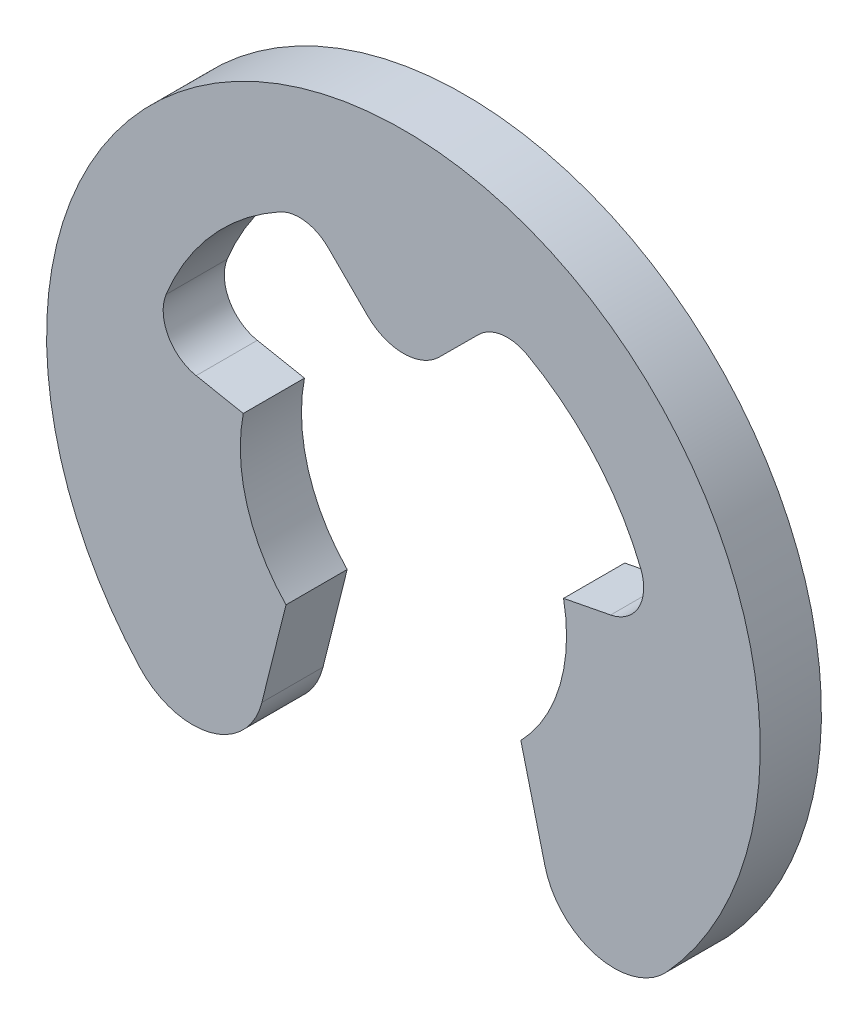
SolidWorks part; units mm, degrees
ref_plane "Plan de face" through (0, 0, 0) normal (0, 0, 1) x (1, 0, 0)
ref_plane "Plan de dessus" through (0, 0, 0) normal (0, 1, 0) x (1, 0, 0)
ref_plane "Plan de droite" through (0, 0, 0) normal (1, 0, 0) x (0, 0, -1)
sketch "Esquisse1" plane through (0, 0, 0) normal (0, 0, 1) x (1, 0, 0)
  line L0 (0, 3.6974) -> (0, -3.9713) construction
  line L1 (-0.3517, 1.7453) -> (-0.7375, 2.1297)
  line L2 (-1.1517, -1.1107) -> (-1.3883, -2.058)
  line L3 (-1.5706, 0.3056) -> (-2.0329, 0.3955)
  line L4 (1.5706, 0.3056) -> (2.0329, 0.3955)
  line L5 (1.1517, -1.1107) -> (1.3883, -2.058)
  line L6 (0.3517, 1.7453) -> (0.7375, 2.1297)
  arc A0 (2.5843, -2.3604) -> (-2.5843, -2.3604) centre (0, 0) ccw
  arc A1 (-1.5706, 0.3056) -> (-1.1517, -1.1107) centre (0, 0) ccw
  arc A2 (-2.0329, 0.3955) -> (-2.3275, 0.9376) centre (-1.9565, 0.7881) cw
  arc A3 (-0.7375, 2.1297) -> (-1.2132, 2.1965) centre (-1.0198, 1.8464) ccw
  arc A4 (-0.3517, 1.7453) -> (0.3517, 1.7453) centre (0, 2.0983) ccw
  arc A5 (-1.2132, 2.1965) -> (-2.3275, 0.9376) centre (0, 0) ccw
  arc A6 (-2.5843, -2.3604) -> (-1.3883, -2.058) centre (-2.0674, -1.8883) ccw
  arc A7 (2.5843, -2.3604) -> (1.3883, -2.058) centre (2.0674, -1.8883) cw
  arc A8 (1.2132, 2.1965) -> (2.3275, 0.9376) centre (0, 0) cw
  arc A9 (0.7375, 2.1297) -> (1.2132, 2.1965) centre (1.0198, 1.8464) cw
  arc A10 (2.0329, 0.3955) -> (2.3275, 0.9376) centre (1.9565, 0.7881) ccw
  arc A11 (1.5706, 0.3056) -> (1.1517, -1.1107) centre (0, 0) cw
  point P18 (0, 0)
  dimension "D1" = 7
  dimension "D2" = 3.2
  dimension "D3" = 0.4
  dimension "D4" = 0.7
extrude "Boss.-Extru.1" add sketch "Esquisse1" along normal blind 0.6
